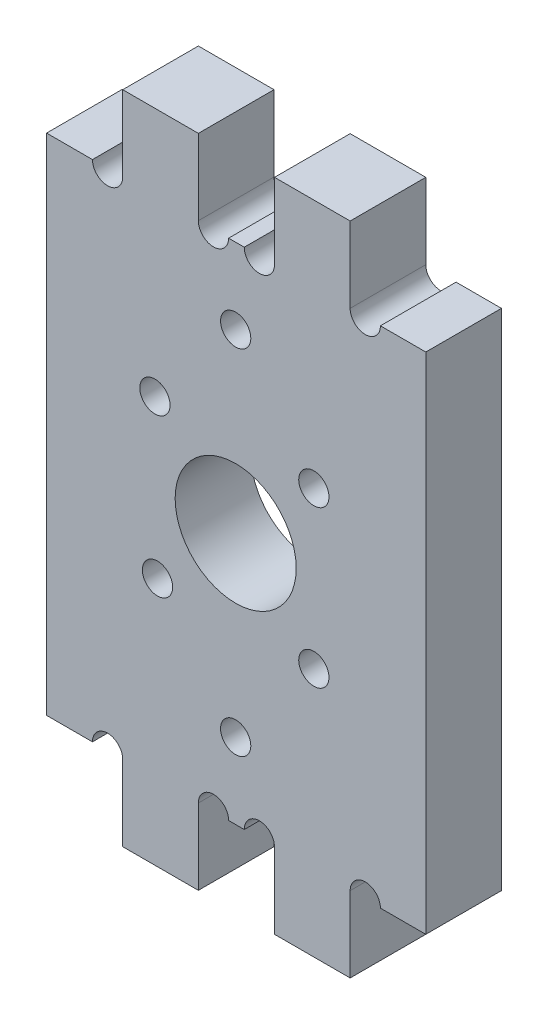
SolidWorks part; units mm, degrees
ref_plane "Ebene vorne" through (0, 0, 0) normal (0, 0, 1) x (1, 0, 0)
ref_plane "Ebene oben" through (0, 0, 0) normal (0, 1, 0) x (1, 0, 0)
ref_plane "Ebene rechts" through (0, 0, 0) normal (1, 0, 0) x (0, 0, -1)
sketch "Skizze1" plane through (0, 0, 0) normal (0, 0, 1) x (1, 0, 0)
  line L0 (0, 0) -> (0, 100)
  line L1 (0, 100) -> (-9, 100)
  line L2 (-15, 100) -> (-15, 115)
  line L5 (-15, 115) -> (-30, 115)
  line L6 (-30, 115) -> (-30, 100)
  line L7 (-36, 100) -> (-39.1, 100)
  line L8 (-45.1, 100) -> (-45.1, 115)
  line L9 (-45.1, 115) -> (-60.1, 115)
  line L10 (-60.1, 115) -> (-60.1, 100)
  line L12 (-66.1, 100) -> (-75.2, 100)
  line L13 (-75.2, 100) -> (-75.2, 0)
  line L14 (-75.2, 0) -> (-66.1, 0)
  line L15 (-60.1, 0) -> (-60.1, -15)
  line L16 (-60.1, -15) -> (-45.1, -15)
  line L17 (-45.1, -15) -> (-45.1, 0)
  line L18 (-36, 0) -> (-39.1, 0)
  line L19 (-30, 0) -> (-30, -15)
  line L20 (-30, -15) -> (-15, -15)
  line L21 (-15, -15) -> (-15, 0)
  line L22 (0, 0) -> (-9, 0)
  arc A0 (-9, 100) -> (-15, 100) centre (-12, 100) cw
  arc A1 (-30, 100) -> (-36, 100) centre (-33, 100) cw
  arc A2 (-39.1, 100) -> (-45.1, 100) centre (-42.1, 100) cw
  arc A3 (-60.1, 100) -> (-66.1, 100) centre (-63.1, 100) cw
  arc A4 (-9, 0) -> (-15, 0) centre (-12, 0) ccw
  arc A5 (-36, 0) -> (-30, 0) centre (-33, 0) cw
  arc A6 (-39.1, 0) -> (-45.1, 0) centre (-42.1, 0) ccw
  arc A7 (-60.1, 0) -> (-66.1, 0) centre (-63.1, 0) ccw
  dimension "D13" = 3
  dimension "D14" = 15
  dimension "D15" = 15
  dimension "D16" = 15
  dimension "D17" = 15
  dimension "D18" = 15
  dimension "D12" = 3
  dimension "D19" = 15
  dimension "D20" = 15.1
  dimension "D21" = 15
  dimension "D22" = 15
  dimension "D23" = 15
  dimension "D1" = 3
  dimension "D2" = 3
  dimension "D3" = 3
  dimension "D4" = 3
  dimension "D10" = 3
  dimension "D11" = 3
  dimension "D5" = 15
  dimension "D6" = 15.1
  dimension "D7" = 15
  dimension "D8" = 15
  dimension "D9" = 15.1
  dimension "D24" = 15
  dimension "D25" = 100
  dimension "D26" = 100
  dimension "D27" = 130
  dimension "D28" = 130
  dimension "D29" = 15
extrude "Aufsatz-Linear austragen1" add sketch "Skizze1" along normal blind 15
sketch "Skizze2" plane through (0, 0, 0) normal (0, 0, -1) x (-1, 0, 0)
  line L2 (36, 0) -> (39.1, 0) construction
  line L3 (75.2, 100) -> (75.2, 0) construction
  circle A0 centre (37.7, 85) radius 5.05
  circle A1 centre (37.7, 15) radius 5.05
  dimension "D1" = 10.1
  dimension "D2" = 10.1
  dimension "D3" = 15
  dimension "D5" = 37.5
  dimension "D4" = 70
extrude "Schnitt-Linear austragen2" cut sketch "Skizze2" against normal blind 7.5
sketch "Skizze3" plane through (0, 0, 0) normal (0, 0, -1) x (-1, 0, 0)
  line L1 (75.2, 100) -> (75.2, 0) construction
  circle A0 centre (37.7, 50) radius 12
  circle A1 centre (37.7, 85) radius 5.05 construction
  circle A2 centre (22.2, 34.5) radius 3
  circle A3 centre (22.2, 65.5) radius 3
  circle A4 centre (53.2, 34.5) radius 3
  circle A5 centre (53.7114, 65.5) radius 3
  circle A6 centre (37.7, 85) radius 3
  circle A7 centre (37.7, 15) radius 3
  dimension "D1" = 35
  dimension "D2" = 24
  dimension "D3" = 37.5
  dimension "D4" = 6
  dimension "D5" = 6
  dimension "D6" = 6
  dimension "D7" = 6
  dimension "D8" = 31
  dimension "D15" = 6
  dimension "D16" = 6
  dimension "D9" = 31
  dimension "D10" = 31
  dimension "D11" = 15.5
  dimension "D12" = 15.5
  dimension "D13" = 15.5
  dimension "D14" = 15.5
extrude "Schnitt-Linear austragen3" cut sketch "Skizze3" against normal blind 17.5
